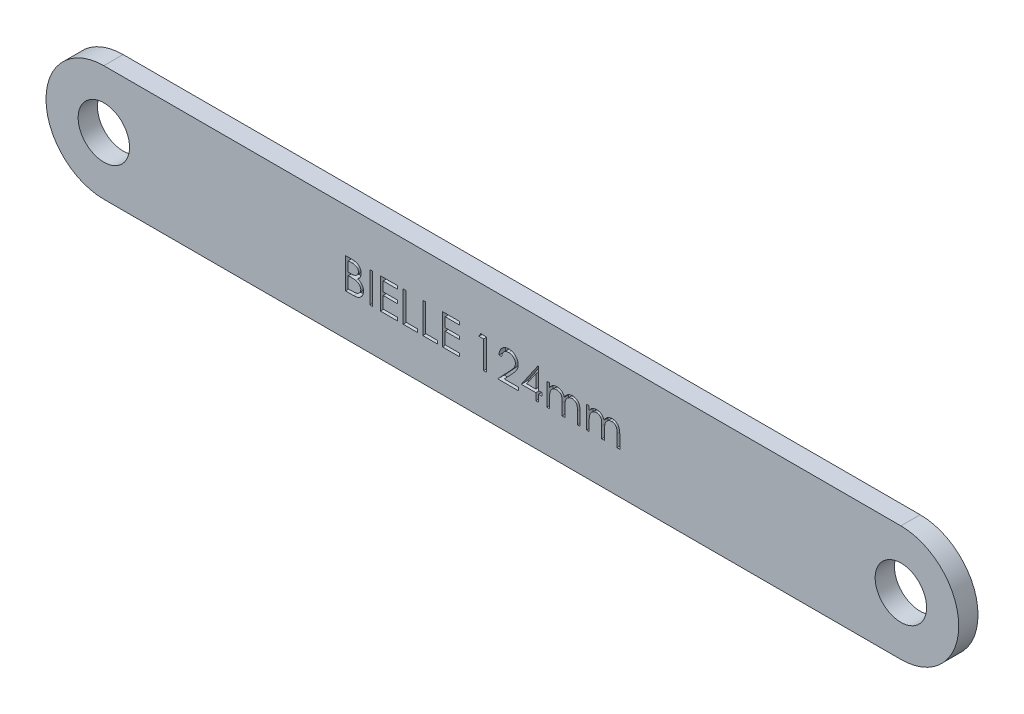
SolidWorks part; units mm, degrees
ref_plane "Plan de face" through (0, 0, 0) normal (0, 0, 1) x (1, 0, 0)
ref_plane "Plan de dessus" through (0, 0, 0) normal (0, 1, 0) x (1, 0, 0)
ref_plane "Plan de droite" through (0, 0, 0) normal (1, 0, 0) x (0, 0, -1)
sketch "Esquisse1" plane through (0, 0, 0) normal (0, 0, 1) x (1, 0, 0)
  line L0 (0, 0) -> (124, 0) construction
  line L1 (0, 0) -> (124, 0) construction
  line L2 (0, 9) -> (124, 9)
  line L3 (0, -9) -> (124, -9)
  arc A1 (0, 9) -> (0, -9) centre (0, 0) ccw
  arc A2 (124, -9) -> (124, 9) centre (124, 0) ccw
  circle A3 centre (0, 0) radius 4
  circle A4 centre (124, 0) radius 4
  point P1 (62, 0)
  dimension "D2" = 9
  dimension "D3" = 8
  dimension "D4" = 8
  dimension "D1" = 124
extrude "Boss.-Extru.1" add sketch "Esquisse1" along normal blind 3
sketch "Esquisse2" plane through (0, 0, 3) normal (0, 0, 1) x (1, 0, 0)
  line L0 (36.9813, -2.5497) -> (98.8109, -2.5497) construction
sketch "Esquisse3" plane through (0, 0, 3) normal (0, 0, 1) x (1, 0, 0)
  text T0 "BIELLE 124mm" font "Century Gothic" height in points 18
extrude "124" cut sketch "Esquisse3" against normal blind 1
sketch "Esquisse4" [suppressed] plane through (0, 0, 3) normal (0, 0, 1) x (1, 0, 0)
  line L0 (35.7065, -2.5497) -> (105.1851, -2.5497) construction
  text T0 "<b>BIELLE 130mm</b>" font "Century Gothic" height in points 18
extrude "130" [suppressed] cut sketch "Esquisse4" against normal blind 1
sketch "Esquisse5" [suppressed] plane through (0, 0, 3) normal (0, 0, 1) x (1, 0, 0)
  line L0 (42.0807, -2.5497) -> (109.169, -2.5497) construction
  text T0 "<b>BIELLE 135mm</b>" font "Century Gothic" height in points 18
extrude "135" [suppressed] cut sketch "Esquisse5" against normal blind 1
